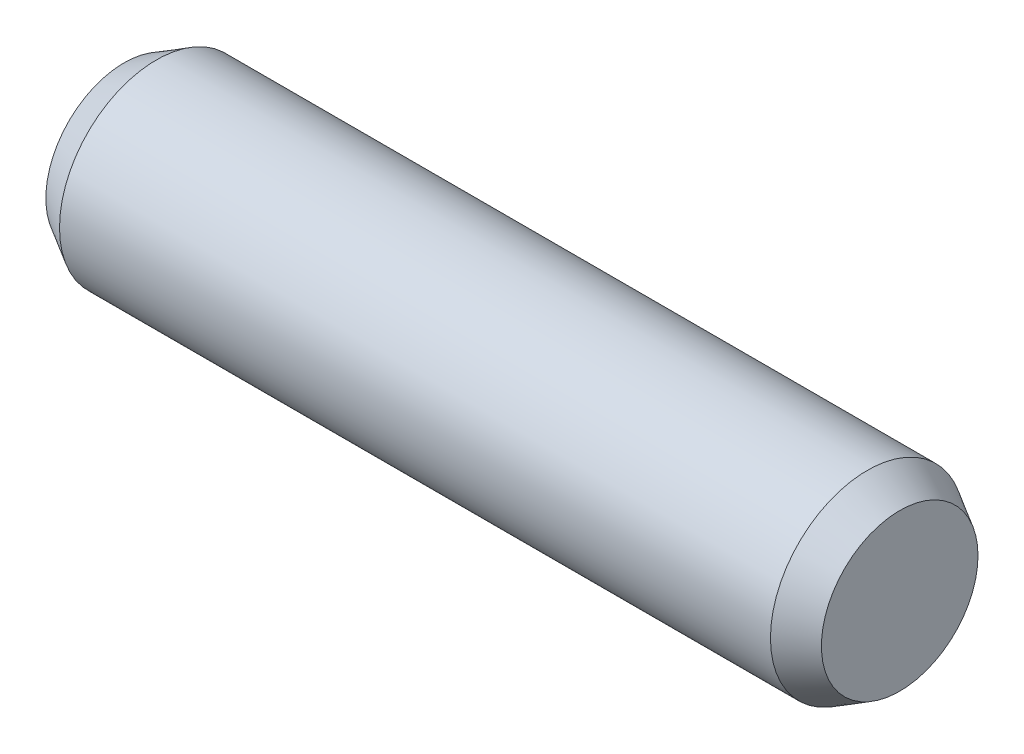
SolidWorks part; units mm, degrees
ref_plane "Plan de face" through (0, 0, 0) normal (0, 0, 1) x (1, 0, 0)
ref_plane "Plan de dessus" through (0, 0, 0) normal (0, 1, 0) x (1, 0, 0)
ref_plane "Plan de droite" through (0, 0, 0) normal (1, 0, 0) x (0, 0, -1)
sketch "Esquisse1" plane through (0, 0, 0) normal (1, 0, 0) x (0, 0, -1)
  circle A0 centre (0, 0) radius 1.5
  dimension "D1" = 3
extrude "Boss.-Extru.1" add sketch "Esquisse1" along normal mid plane 12
chamfer "Chanfrein2" distance 0.5 angle 30 2 edges at (-6, 0, -1.5) (6, 0, -1.5)
